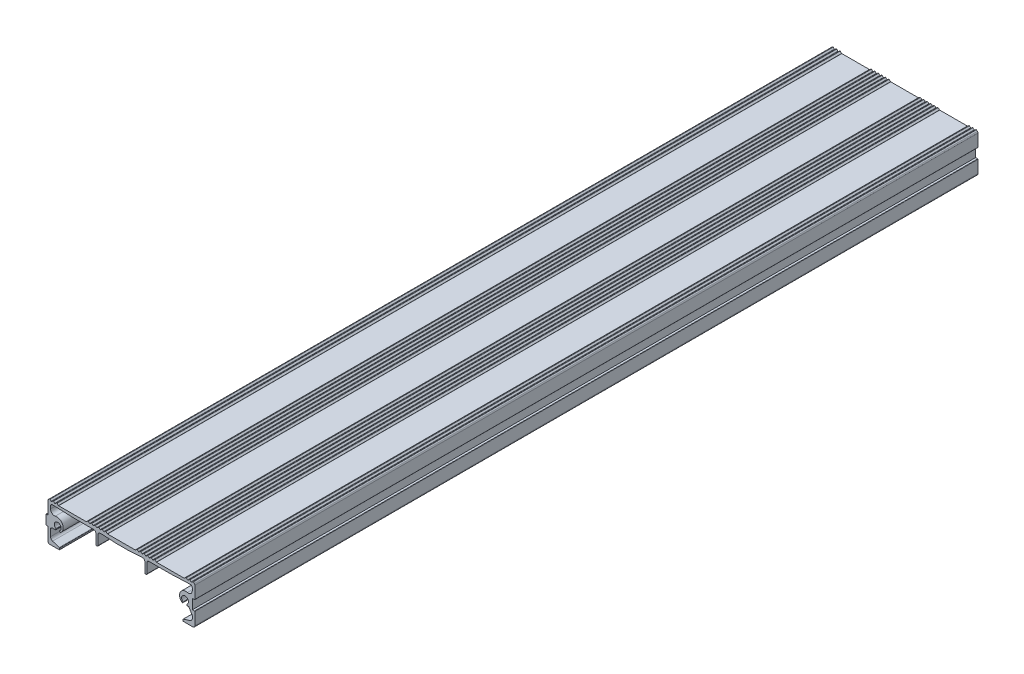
SolidWorks part; units mm, degrees
ref_plane "Спереди" through (0, 0, 0) normal (0, 0, 1) x (1, 0, 0)
ref_plane "Сверху" through (0, 0, 0) normal (0, 1, 0) x (1, 0, 0)
ref_plane "Справа" through (0, 0, 0) normal (1, 0, 0) x (0, 0, -1)
sketch "Эскиз1" plane through (0, 0, 0) normal (0, 0, 1) x (1, 0, 0)
  line L0 (75.8319, -4.6189) -> (73.7319, -4.6189)
  line L1 (73.7319, -4.6189) -> (73.7319, 5.3811)
  line L2 (73.7319, 5.3811) -> (75.8319, 5.3811)
  line L3 (76.1319, 5.6811) -> (76.1319, 18.2817)
  line L4 (75.5562, 19.5109) -> (74.588, 20.3177)
  line L5 (74.0759, 20.3177) -> (72.788, 19.2445)
  line L6 (72.2759, 19.2445) -> (70.988, 20.3177)
  line L7 (70.4759, 20.3177) -> (69.188, 19.2445)
  line L8 (68.6759, 19.2445) -> (67.388, 20.3177)
  line L9 (66.8759, 20.3177) -> (65.4432, 19.1238)
  line L10 (65.1871, 19.0311) -> (37.0767, 19.0311)
  line L11 (36.8207, 19.1238) -> (35.388, 20.3177)
  line L12 (34.8759, 20.3177) -> (33.588, 19.2445)
  line L13 (33.0759, 19.2445) -> (31.788, 20.3177)
  line L14 (31.2759, 20.3177) -> (29.988, 19.2445)
  line L15 (29.4759, 19.2445) -> (28.188, 20.3177)
  line L16 (27.6759, 20.3177) -> (26.324, 19.1912)
  line L17 (25.9399, 19.1912) -> (24.588, 20.3177)
  line L18 (24.0759, 20.3177) -> (22.788, 19.2445)
  line L19 (22.2759, 19.2445) -> (20.988, 20.3177)
  line L20 (20.4759, 20.3177) -> (19.188, 19.2445)
  line L21 (18.6759, 19.2445) -> (17.388, 20.3177)
  line L22 (16.8759, 20.3177) -> (15.4432, 19.1238)
  line L23 (15.1871, 19.0311) -> (-12.9233, 19.0311)
  line L24 (-13.1793, 19.1238) -> (-14.612, 20.3177)
  line L25 (-15.1241, 20.3177) -> (-16.412, 19.2445)
  line L26 (-16.9241, 19.2445) -> (-18.212, 20.3177)
  line L27 (-18.7241, 20.3177) -> (-20.012, 19.2445)
  line L28 (-20.5241, 19.2445) -> (-21.812, 20.3177)
  line L29 (-22.3241, 20.3177) -> (-23.676, 19.1912)
  line L30 (-24.0601, 19.1912) -> (-25.412, 20.3177)
  line L31 (-25.9241, 20.3177) -> (-27.212, 19.2445)
  line L32 (-27.7241, 19.2445) -> (-29.012, 20.3177)
  line L33 (-29.5241, 20.3177) -> (-30.812, 19.2445)
  line L34 (-31.3241, 19.2445) -> (-32.612, 20.3177)
  line L35 (-33.1241, 20.3177) -> (-34.5568, 19.1238)
  line L36 (-34.8129, 19.0311) -> (-62.9233, 19.0311)
  line L37 (-63.1793, 19.1238) -> (-64.612, 20.3177)
  line L38 (-65.1241, 20.3177) -> (-66.412, 19.2445)
  line L39 (-66.9241, 19.2445) -> (-68.212, 20.3177)
  line L40 (-68.7241, 20.3177) -> (-70.012, 19.2445)
  line L41 (-70.5241, 19.2445) -> (-71.812, 20.3177)
  line L42 (-72.3241, 20.3177) -> (-73.2924, 19.5109)
  line L43 (-73.8681, 18.2817) -> (-73.8681, 5.2811)
  line L44 (-73.8681, 5.2811) -> (-75.6181, 5.2811)
  line L45 (-75.8681, 5.0311) -> (-75.8681, -4.2689)
  line L46 (-75.6181, -4.5189) -> (-73.8681, -4.5189)
  line L47 (-73.8681, -4.5189) -> (-73.8681, -17.6189)
  line L48 (-71.8681, -19.6189) -> (-62.3681, -19.6189)
  line L49 (-61.8681, -19.1189) -> (-61.8681, -17.9879)
  line L50 (-62.2207, -17.5101) -> (-69.1525, -15.3716)
  line L51 (-71.2681, -12.5049) -> (-71.2681, -5.8205)
  line L52 (-69.2681, -3.8205) -> (-66.1681, -3.8205)
  line L53 (-65.6681, -3.3205) -> (-65.6681, -2.8915)
  line L54 (-61.8271, -3.0224) -> (-61.6228, -3.3631)
  line L55 (-71.2681, 12.0283) -> (-71.2681, 14.7492)
  line L56 (-69.1878, 16.7475) -> (-48.8681, 15.9311)
  line L57 (-48.8681, 15.9311) -> (-26.9681, 15.9311)
  line L58 (-24.9681, 13.9311) -> (-24.9681, 3.9311)
  line L59 (-23.9681, 2.9311) -> (-23.7681, 2.9311)
  line L60 (-22.7681, 3.9311) -> (-22.7681, 13.9311)
  line L61 (-20.7681, 15.9311) -> (-16.8681, 15.9311)
  line L62 (19.1319, 15.9311) -> (23.0319, 15.9311)
  line L63 (25.0319, 13.9311) -> (25.0319, 3.9311)
  line L64 (26.0319, 2.9311) -> (26.2319, 2.9311)
  line L65 (27.2319, 3.9311) -> (27.2319, 13.9311)
  line L66 (29.2319, 15.9311) -> (51.1319, 15.9311)
  line L67 (51.1319, 15.9311) -> (71.4516, 16.7475)
  line L68 (73.5319, 14.7492) -> (73.5319, 12.0283)
  line L69 (63.8867, -3.3631) -> (64.0909, -3.0224)
  line L70 (67.9319, -2.8915) -> (67.9319, -3.3205)
  line L71 (68.4319, -3.8205) -> (70.0319, -3.8205)
  line L72 (70.0319, -3.8205) -> (73.5319, -9.8205)
  line L73 (73.5319, -9.8205) -> (73.5319, -12.5049)
  line L74 (71.4163, -15.3716) -> (64.4845, -17.5101)
  line L75 (64.1319, -17.9879) -> (64.1319, -19.1189)
  line L76 (64.6319, -19.6189) -> (74.1319, -19.6189)
  line L77 (76.1319, -17.6189) -> (76.1319, -4.9189)
  arc A0 (76.1319, -4.9189) -> (75.8319, -4.6189) centre (75.8319, -4.9189) ccw
  arc A1 (75.8319, 5.3811) -> (76.1319, 5.6811) centre (75.8319, 5.6811) ccw
  arc A2 (76.1319, 18.2817) -> (75.5562, 19.5109) centre (74.5319, 18.2817) ccw
  arc A3 (74.588, 20.3177) -> (74.0759, 20.3177) centre (74.3319, 20.0104) ccw
  arc A4 (72.2759, 19.2445) -> (72.788, 19.2445) centre (72.5319, 19.5518) ccw
  arc A5 (70.988, 20.3177) -> (70.4759, 20.3177) centre (70.7319, 20.0104) ccw
  arc A6 (68.6759, 19.2445) -> (69.188, 19.2445) centre (68.9319, 19.5518) ccw
  arc A7 (67.388, 20.3177) -> (66.8759, 20.3177) centre (67.1319, 20.0104) ccw
  arc A8 (65.1871, 19.0311) -> (65.4432, 19.1238) centre (65.1871, 19.4311) ccw
  arc A9 (36.8207, 19.1238) -> (37.0767, 19.0311) centre (37.0767, 19.4311) ccw
  arc A10 (35.388, 20.3177) -> (34.8759, 20.3177) centre (35.1319, 20.0104) ccw
  arc A11 (33.0759, 19.2445) -> (33.588, 19.2445) centre (33.3319, 19.5518) ccw
  arc A12 (31.788, 20.3177) -> (31.2759, 20.3177) centre (31.5319, 20.0104) ccw
  arc A13 (29.4759, 19.2445) -> (29.988, 19.2445) centre (29.7319, 19.5518) ccw
  arc A14 (28.188, 20.3177) -> (27.6759, 20.3177) centre (27.9319, 20.0104) ccw
  arc A15 (25.9399, 19.1912) -> (26.324, 19.1912) centre (26.1319, 19.4216) ccw
  arc A16 (24.588, 20.3177) -> (24.0759, 20.3177) centre (24.3319, 20.0104) ccw
  arc A17 (22.2759, 19.2445) -> (22.788, 19.2445) centre (22.5319, 19.5518) ccw
  arc A18 (20.988, 20.3177) -> (20.4759, 20.3177) centre (20.7319, 20.0104) ccw
  arc A19 (18.6759, 19.2445) -> (19.188, 19.2445) centre (18.9319, 19.5518) ccw
  arc A20 (17.388, 20.3177) -> (16.8759, 20.3177) centre (17.1319, 20.0104) ccw
  arc A21 (15.1871, 19.0311) -> (15.4432, 19.1238) centre (15.1871, 19.4311) ccw
  arc A22 (-13.1793, 19.1238) -> (-12.9233, 19.0311) centre (-12.9233, 19.4311) ccw
  arc A23 (-14.612, 20.3177) -> (-15.1241, 20.3177) centre (-14.8681, 20.0104) ccw
  arc A24 (-16.9241, 19.2445) -> (-16.412, 19.2445) centre (-16.6681, 19.5518) ccw
  arc A25 (-18.212, 20.3177) -> (-18.7241, 20.3177) centre (-18.4681, 20.0104) ccw
  arc A26 (-20.5241, 19.2445) -> (-20.012, 19.2445) centre (-20.2681, 19.5518) ccw
  arc A27 (-21.812, 20.3177) -> (-22.3241, 20.3177) centre (-22.0681, 20.0104) ccw
  arc A28 (-24.0601, 19.1912) -> (-23.676, 19.1912) centre (-23.8681, 19.4216) ccw
  arc A29 (-25.412, 20.3177) -> (-25.9241, 20.3177) centre (-25.6681, 20.0104) ccw
  arc A30 (-27.7241, 19.2445) -> (-27.212, 19.2445) centre (-27.4681, 19.5518) ccw
  arc A31 (-29.012, 20.3177) -> (-29.5241, 20.3177) centre (-29.2681, 20.0104) ccw
  arc A32 (-31.3241, 19.2445) -> (-30.812, 19.2445) centre (-31.0681, 19.5518) ccw
  arc A33 (-32.612, 20.3177) -> (-33.1241, 20.3177) centre (-32.8681, 20.0104) ccw
  arc A34 (-34.8129, 19.0311) -> (-34.5568, 19.1238) centre (-34.8129, 19.4311) ccw
  arc A35 (-63.1793, 19.1238) -> (-62.9233, 19.0311) centre (-62.9233, 19.4311) ccw
  arc A36 (-64.612, 20.3177) -> (-65.1241, 20.3177) centre (-64.8681, 20.0104) ccw
  arc A37 (-66.9241, 19.2445) -> (-66.412, 19.2445) centre (-66.6681, 19.5518) ccw
  arc A38 (-68.212, 20.3177) -> (-68.7241, 20.3177) centre (-68.4681, 20.0104) ccw
  arc A39 (-70.5241, 19.2445) -> (-70.012, 19.2445) centre (-70.2681, 19.5518) ccw
  arc A40 (-71.812, 20.3177) -> (-72.3241, 20.3177) centre (-72.0681, 20.0104) ccw
  arc A41 (-73.2924, 19.5109) -> (-73.8681, 18.2817) centre (-72.2681, 18.2817) ccw
  arc A42 (-75.6181, 5.2811) -> (-75.8681, 5.0311) centre (-75.6181, 5.0311) ccw
  arc A43 (-75.8681, -4.2689) -> (-75.6181, -4.5189) centre (-75.6181, -4.2689) ccw
  arc A44 (-73.8681, -17.6189) -> (-71.8681, -19.6189) centre (-71.8681, -17.6189) ccw
  arc A45 (-62.3681, -19.6189) -> (-61.8681, -19.1189) centre (-62.3681, -19.1189) ccw
  arc A46 (-61.8681, -17.9879) -> (-62.2207, -17.5101) centre (-62.3681, -17.9879) ccw
  arc A47 (-71.2681, -12.5049) -> (-69.1525, -15.3716) centre (-68.2681, -12.5049) ccw
  arc A48 (-69.2681, -3.8205) -> (-71.2681, -5.8205) centre (-69.2681, -5.8205) ccw
  arc A49 (-66.1681, -3.8205) -> (-65.6681, -3.3205) centre (-66.1681, -3.3205) ccw
  arc A50 (-65.6681, -2.8915) -> (-65.8806, -2.4824) centre (-66.1681, -2.8915) ccw
  arc A51 (-61.707, -2.372) -> (-65.8806, -2.4824) centre (-63.8681, 0.3811) ccw
  arc A52 (-61.707, -2.372) -> (-61.8271, -3.0224) centre (-61.3983, -2.7653) ccw
  arc A53 (-61.6228, -3.3631) -> (-60.8916, -3.5041) centre (-61.194, -3.1059) ccw
  arc A54 (-60.8916, -3.5041) -> (-66.3597, 8.1328) centre (-64.8668, 1.7311) ccw
  arc A55 (-71.2681, 12.0283) -> (-66.3597, 8.1328) centre (-67.2681, 12.0283) ccw
  arc A56 (-69.1878, 16.7475) -> (-71.2681, 14.7492) centre (-69.2681, 14.7492) ccw
  arc A57 (-24.9681, 13.9311) -> (-26.9681, 15.9311) centre (-26.9681, 13.9311) ccw
  arc A58 (-24.9681, 3.9311) -> (-23.9681, 2.9311) centre (-23.9681, 3.9311) ccw
  arc A59 (-23.7681, 2.9311) -> (-22.7681, 3.9311) centre (-23.7681, 3.9311) ccw
  arc A60 (-20.7681, 15.9311) -> (-22.7681, 13.9311) centre (-20.7681, 13.9311) ccw
  arc A61 (-16.8681, 15.9311) -> (19.1319, 15.9311) centre (1.1319, 195.4811) ccw
  arc A62 (25.0319, 13.9311) -> (23.0319, 15.9311) centre (23.0319, 13.9311) ccw
  arc A63 (25.0319, 3.9311) -> (26.0319, 2.9311) centre (26.0319, 3.9311) ccw
  arc A64 (26.2319, 2.9311) -> (27.2319, 3.9311) centre (26.2319, 3.9311) ccw
  arc A65 (29.2319, 15.9311) -> (27.2319, 13.9311) centre (29.2319, 13.9311) ccw
  arc A66 (73.5319, 14.7492) -> (71.4516, 16.7475) centre (71.5319, 14.7492) ccw
  arc A67 (68.6235, 8.1328) -> (73.5319, 12.0283) centre (69.5319, 12.0283) ccw
  arc A68 (68.6235, 8.1328) -> (63.1555, -3.5041) centre (67.1307, 1.7311) ccw
  arc A69 (63.1555, -3.5041) -> (63.8867, -3.3631) centre (63.4579, -3.1059) ccw
  arc A70 (64.0909, -3.0224) -> (63.9708, -2.372) centre (63.6621, -2.7653) ccw
  arc A71 (68.1444, -2.4824) -> (63.9708, -2.372) centre (66.1319, 0.3811) ccw
  arc A72 (68.1444, -2.4824) -> (67.9319, -2.8915) centre (68.4319, -2.8915) ccw
  arc A73 (67.9319, -3.3205) -> (68.4319, -3.8205) centre (68.4319, -3.3205) ccw
  arc A74 (71.4163, -15.3716) -> (73.5319, -12.5049) centre (70.5319, -12.5049) ccw
  arc A75 (64.4845, -17.5101) -> (64.1319, -17.9879) centre (64.6319, -17.9879) ccw
  arc A76 (64.1319, -19.1189) -> (64.6319, -19.6189) centre (64.6319, -19.1189) ccw
  arc A77 (74.1319, -19.6189) -> (76.1319, -17.6189) centre (74.1319, -17.6189) ccw
extrude "Бобышка-Вытянуть1" add sketch "Эскиз1" along normal blind 800
